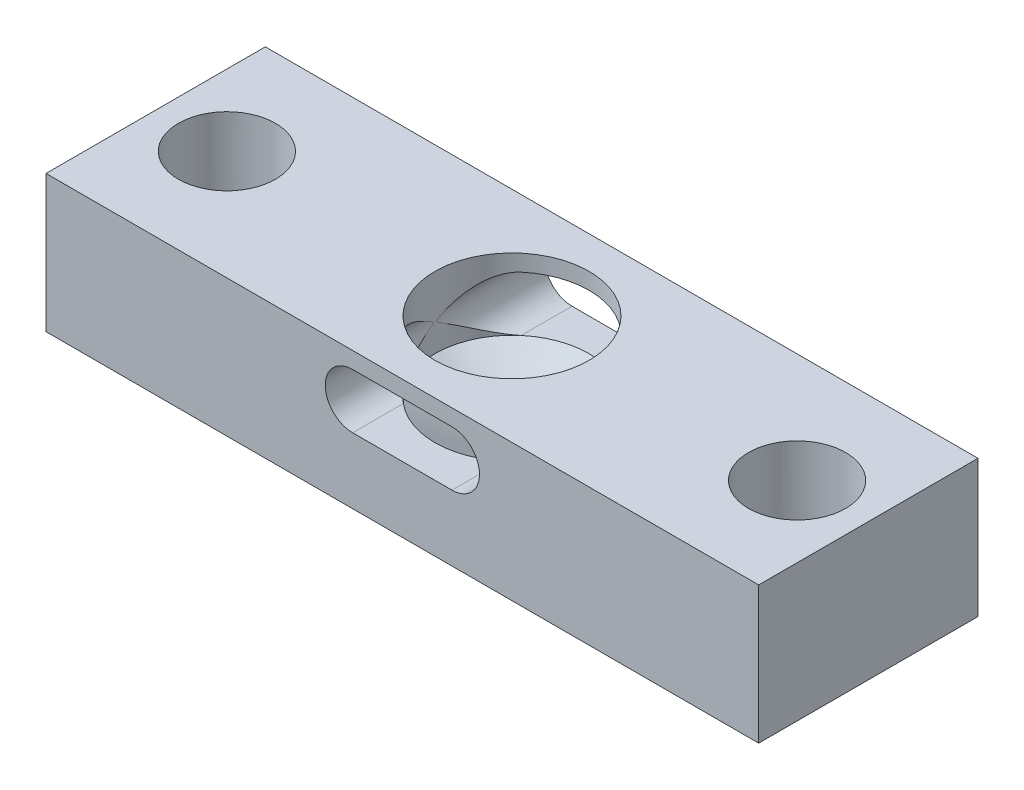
SolidWorks part; units mm, degrees
ref_plane "Front Plane" through (0, 0, 0) normal (0, 0, 1) x (1, 0, 0)
ref_plane "Top Plane" through (0, 0, 0) normal (0, 1, 0) x (1, 0, 0)
ref_plane "Right Plane" through (0, 0, 0) normal (1, 0, 0) x (0, 0, -1)
sketch "Sketch1" plane through (0, 0, 0) normal (0, 0, 1) x (1, 0, 0)
  line L1 (-29.3592, 20.1742) -> (3.6608, 20.1742)
  line L2 (-29.3592, 20.1742) -> (-29.3592, 7.4742)
  line L3 (-29.3592, 7.4742) -> (3.6608, 7.4742)
  line L4 (3.6608, 20.1742) -> (3.6608, 7.4742)
extrude "Boss-Extrude1" add sketch "Sketch1" along normal blind 10.16
hole_wizard "#16 (0.177) Diameter Hole1" positions "Sketch4" profile "Sketch5" hole size "#16" standard "ANSI Inch"
sketch "Sketch4" plane through (0, 20.1742, 0) normal (0, 1, 0) x (1, 0, 0)
  line L0 (3.6608, 0) -> (-29.3592, 0) construction
  line L1 (3.6608, -10.16) -> (3.6608, 0) construction
  line L2 (-29.3592, -10.16) -> (-29.3592, 0) construction
  point P0 (-26.0572, -5.08)
  point P2 (0.3588, -5.08)
  dimension "D1" = 5.08
  dimension "D2" = 5.08
  dimension "D3" = 3.302
  dimension "D4" = 3.302
sketch "Sketch5" plane through (-26.0572, 20.1742, 5.08) normal (1, 0, 0) x (0, 0, 1)
  line L0 (0, 0) -> (0, 12.7)
  line L1 (0, 12.7) -> (2.2479, 12.7)
  line L2 (2.2479, 12.7) -> (2.2479, 0)
  line L5 (2.2479, 0) -> (0, 0)
  line L11 (0, -6.35) -> (0, 107.95) construction
  dimension "Thru Hole Dia." = 4.4958
  dimension "Thru Hole Depth" = 12.7
hole_wizard "9/32 (0.28125) Diameter Hole1" positions "Sketch10" profile "Sketch11" hole size "9/32" standard "ANSI Inch"
sketch "Sketch10" plane through (0, 20.1742, 0) normal (0, 1, 0) x (1, 0, 0)
  line L0 (3.6608, 0) -> (-29.3592, 0) construction
  line L1 (-29.3592, -10.16) -> (-29.3592, 0) construction
  point P0 (-12.8492, -5.08)
  dimension "D1" = 5.08
  dimension "D2" = 16.51
sketch "Sketch11" plane through (-12.8492, 20.1742, 5.08) normal (1, 0, 0) x (0, 0, 1)
  line L0 (0, 0) -> (0, 5.4482)
  line L1 (0, 5.4482) -> (3.5719, 3.302)
  line L2 (3.5719, 3.302) -> (3.5719, 0)
  line L5 (3.5719, 0) -> (0, 0)
  line L10 (0, 5.4482) -> (-3.5719, 3.302) construction
  line L11 (0, -6.35) -> (0, 107.95) construction
  dimension "Hole Dia." = 7.1437
  dimension "Hole Depth" = 3.302
  dimension "Drill Angle" = 118
sketch "Sketch12" plane through (0, 0, 10.16) normal (0, 0, 1) x (1, 0, 0)
  line L0 (-15.1504, 18.1422) -> (-10.548, 18.1422) construction
  line L1 (-15.1504, 19.4122) -> (-10.548, 19.4122)
  line L2 (-15.1504, 16.8722) -> (-10.548, 16.8722)
  line L3 (-29.3592, 20.1742) -> (-29.3592, 7.4742) construction
  line L5 (3.6608, 20.1742) -> (-29.3592, 20.1742) construction
  arc A0 (-15.1504, 19.4122) -> (-15.1504, 16.8722) centre (-15.1504, 18.1422) ccw
  arc A1 (-10.548, 16.8722) -> (-10.548, 19.4122) centre (-10.548, 18.1422) ccw
  point P2 (-12.8492, 18.1422)
  point P7 (-16.4204, 18.1422)
  point P8 (-9.278, 18.1422)
  dimension "D2" = 7.1425
  dimension "D1" = 2.54
  dimension "D3" = 16.51
  dimension "D4" = 3.302
extrude "Cut-Extrude1" cut sketch "Sketch12" against normal through all
sketch "Sketch13" plane through (0, 0, 10.16) normal (0, 0, 1) x (1, 0, 0)
  line L0 (-29.3592, 13.8242) -> (3.6608, 13.8242)
  line L1 (-29.3592, 20.1742) -> (-29.3592, 7.4742) construction
  line L2 (3.6608, 7.4742) -> (3.6608, 20.1742) construction
  line L3 (3.6608, 13.8242) -> (-29.3592, 13.8242)
  line L4 (3.6608, 20.1742) -> (-29.3592, 20.1742) construction
  dimension "D1" = 6.35
extrude "Cut-Extrude2" cut sketch "Sketch13" against normal through all contours L0 M6 M7 M8
